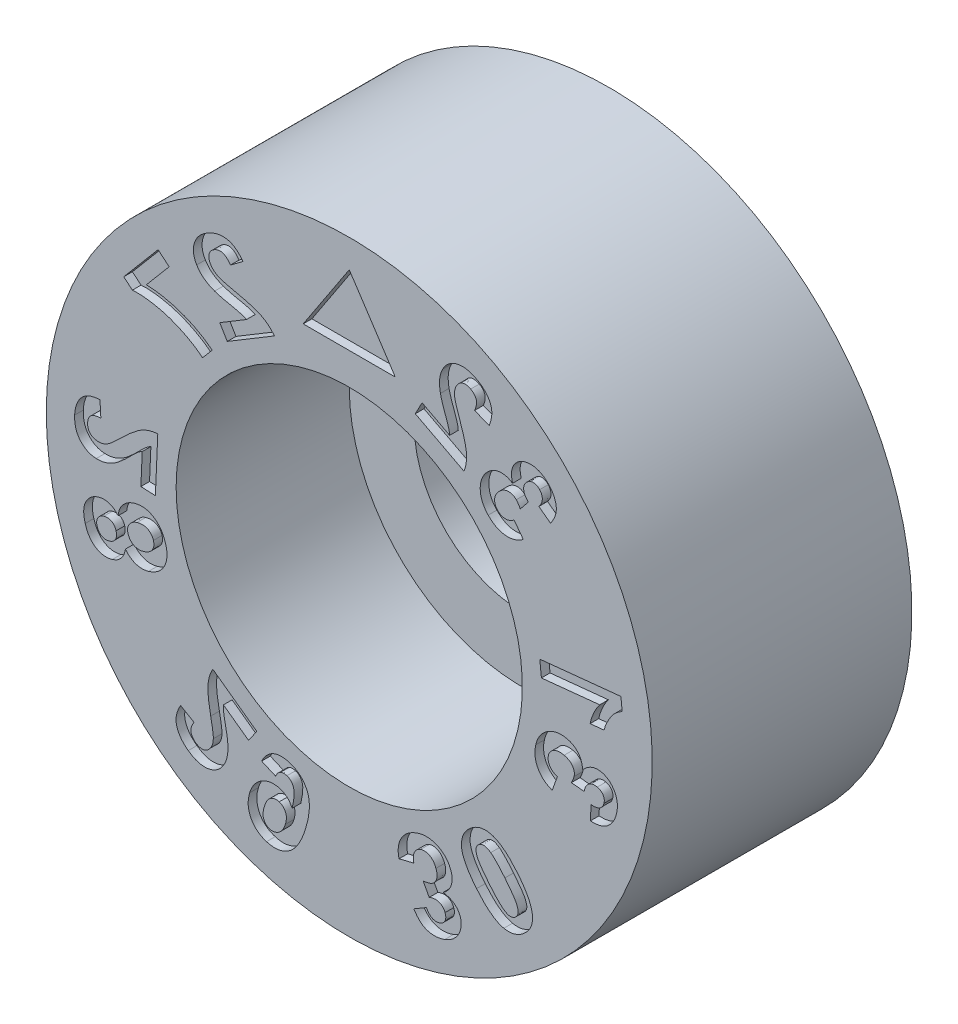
SolidWorks part; units mm, degrees
ref_plane "Front Plane" through (0, 0, 0) normal (0, 0, 1) x (1, 0, 0)
ref_plane "Top Plane" through (0, 0, 0) normal (0, 1, 0) x (1, 0, 0)
ref_plane "Right Plane" through (0, 0, 0) normal (1, 0, 0) x (0, 0, -1)
imported_body "Imported1"
other "Move Face1" parameters "D1"=0.22
other "DeleteFace2"
sketch "Sketch1" plane through (0, 0, 0) normal (0, 0, 1) x (1, 0, 0)
  arc A0 (-0.8358, 2.0974) -> (0.9668, 2.0403) centre (0, 0) ccw construction
  text T2 "27  28  29  30  31  32" font "Arial" height 0.95
  dimension "D1" = 2.2578
extrude "Cut-Extrude1" cut sketch "Sketch1" against normal blind 0.1
other "Move Face2" parameters "D1"=1
other "Move Face3" parameters "D1"=2
sketch "Sketch2" plane through (0, 0, 0) normal (0, 1, 0) x (1, 0, 0)
  line L0 (3.5, 3) -> (-3.5, 3) construction
  line L1 (-2.2, 3) -> (-2.8, 3)
  arc A0 (-2.8, 3) -> (-2.2, 3) centre (-2.5, 3) cw
  dimension "D2" = 0.3
  dimension "D1" = 2.5
revolve "Revolve1" add sketch "Sketch2" angle 360 about L1
